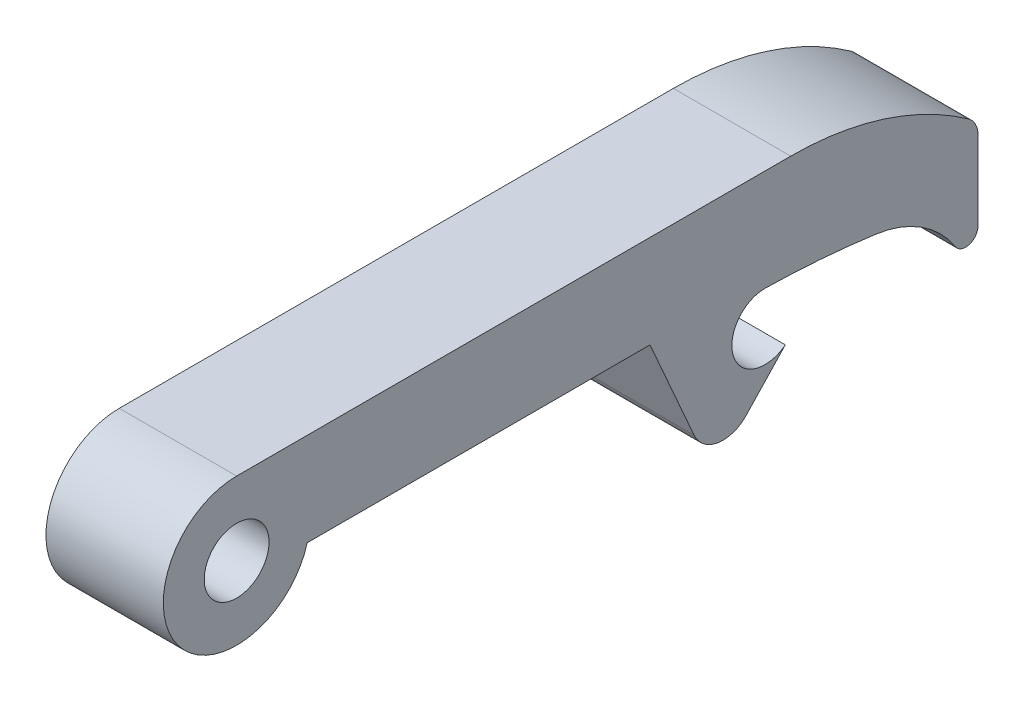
SolidWorks part; units mm, degrees
ref_plane "Front" through (0, 0, 0) normal (0, 0, 1) x (1, 0, 0)
ref_plane "Top" through (0, 0, 0) normal (0, 1, 0) x (1, 0, 0)
ref_plane "Right" through (0, 0, 0) normal (1, 0, 0) x (0, 0, -1)
sketch "Sketch1" plane through (0, 0, 0) normal (1, 0, 0) x (0, 0, -1)
  line L0 (-286.1952, 21.3787) -> (13.6201, 21.3787)
  line L1 (114.9561, -19.2579) -> (114.9561, -61.9717)
  line L2 (10.6894, -65.5802) -> (-10.5223, -88.079)
  line L3 (-38.6844, -83.2179) -> (-62.5236, -28.9798)
  line L4 (-62.5236, -28.9798) -> (-247.9934, -28.9798)
  arc A0 (13.6201, 21.3787) -> (109.8011, -9.279) centre (13.6201, -144.8223) cw
  arc A1 (109.8011, -9.279) -> (114.9561, -19.2579) centre (102.7201, -19.2579) cw
  arc A2 (114.9561, -61.9717) -> (102.7201, -65.5802) centre (108.306, -61.9717) cw
  arc A3 (102.7201, -65.5802) -> (59.7978, -38.2588) centre (51.5031, -98.6663) ccw
  arc A4 (59.7978, -38.2588) -> (0, -33.6193) centre (-9.3551, -541.8797) ccw
  arc A5 (0, -33.6193) -> (10.6894, -65.5802) centre (-0.3291, -51.4973) ccw
  arc A6 (-10.5223, -88.079) -> (-38.6844, -83.2179) centre (-22.9934, -76.3213) cw
  arc A7 (-286.1952, 21.3787) -> (-247.9934, -28.9798) centre (-286.1952, -18.2905) ccw
extrude "Extrude1" add sketch "Sketch1" along normal mid plane 63.5
sketch "Sketch3" plane through (31.75, 0, 0) normal (1, 0, 0) x (0, 0, -1)
  circle A0 centre (-286.1952, -18.2905) radius 17.5362
extrude "Cut-Extrude1" cut sketch "Sketch3" against normal through all
